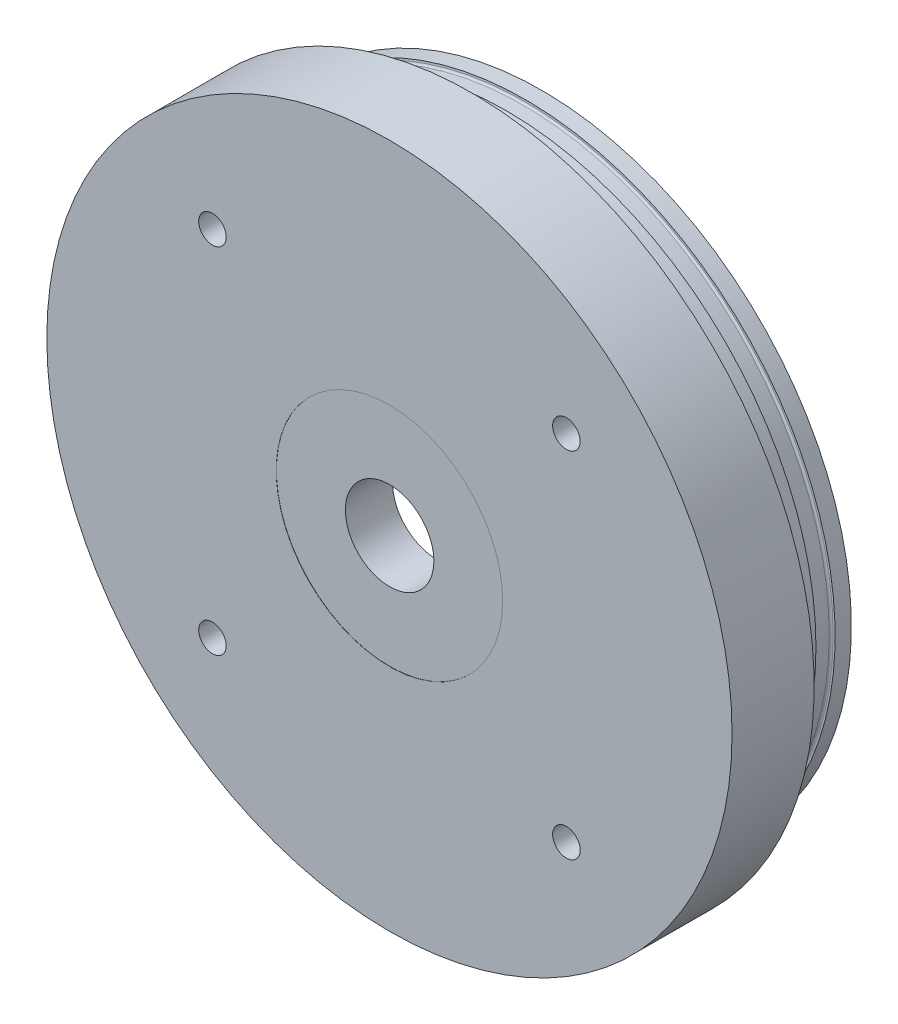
SolidWorks part; units mm, degrees
ref_plane "Front Plane" through (0, 0, 0) normal (0, 0, 1) x (1, 0, 0)
ref_plane "Top Plane" through (0, 0, 0) normal (0, 1, 0) x (1, 0, 0)
ref_plane "Right Plane" through (0, 0, 0) normal (1, 0, 0) x (0, 0, -1)
sketch "Sketch1" plane through (0, 0, 0) normal (0, 0, 1) x (1, 0, 0)
  circle A0 centre (0, 0) radius 43.0276
  dimension "D1" = 86.0552
extrude "Extrude1" add sketch "Sketch1" along normal blind 19.1262
ref_plane "Plane1" through (0, 0, 19.1262) normal (0, 0, 1) x (1, 0, 0)
sketch "Sketch3" plane through (0, 0, 19.1262) normal (0, 0, 1) x (1, 0, 0)
  circle A0 centre (0, 0) radius 42.926
hole_wizard "#4-40 Tapped Hole1" positions "3DSketch1" profile "Sketch5" tap size "#4-40" standard "Ansi Inch"
sketch3d "3DSketch1"
  point P40 (0, 32.639, 0)
  dimension "D1" = 32.639
sketch "Sketch5" plane through (0, 32.639, 0) normal (1, 0, 0) x (0, 1, 0)
  line L0 (0, 0) -> (0, 12.1092)
  line L1 (0, 12.1092) -> (1.1303, 11.43)
  line L2 (1.1303, 11.43) -> (1.1303, 0)
  line L5 (1.1303, 0) -> (0, 0)
  line L10 (0, 12.1092) -> (-1.1303, 11.43) construction
  line L11 (0, -6.35) -> (0, 107.95) construction
  dimension "Tap Drill Dia." = 2.2606
  dimension "Tap Drill Depth" = 11.43
  dimension "Drill Angle" = 118
sketch "Sketch6" plane through (0, 0, 19.1262) normal (0, 0, 1) x (1, 0, 0)
  circle A0 centre (0, 0) radius 9.525
extrude "Extrude5" [suppressed] cut sketch "Sketch6" against normal through all
sketch "Sketch11" plane through (0, 0, 0) normal (0, 0, -1) x (-1, 0, 0)
  circle A0 centre (0, 0) radius 56.9733
  circle A1 centre (0, 0) radius 38.8874
  dimension "D1" = 77.7748
extrude "Extrude9" cut sketch "Sketch11" against normal blind 8.8138
chamfer "Chamfer1" [suppressed] distance 0.635 angle 20
sketch "Sketch7" plane through (0, 0, 19.1262) normal (0, 0, 1) x (1, 0, 0)
  circle A0 centre (0, 0) radius 14.224
  dimension "D1" = 28.448
extrude "Extrude6" cut sketch "Sketch7" against normal blind 0.0254
hole_wizard "#6-32 Tapped Hole1" positions "3DSketch2" profile "Sketch8" tap size "#6-32" standard "Ansi Inch"
sketch3d "3DSketch2"
  line L16 (0, 0, 19.1262) -> (-12.9495, 12.9495, 19.1262) construction
  line L18 (0, 0, 19.1262) -> (0, 21.6239, 19.1262) construction
  circle A4 centre (0, 0, 19.1262) radius 42.926 construction
  point P47 (-12.9495, 12.9495, 19.1262)
  point P58 (0, 0, 62.0522)
  dimension "D1" = 18.3134
  dimension "D2" = 45
sketch "Sketch8" plane through (-12.9495, 12.9495, 19.1262) normal (1, 0, 0) x (0, -1, 0)
  line L0 (0, 0) -> (0, 12.0612)
  line L1 (0, 12.0612) -> (1.4732, 11.176)
  line L2 (1.4732, 11.176) -> (1.4732, 0)
  line L5 (1.4732, 0) -> (0, 0)
  line L10 (0, 12.0612) -> (-1.4732, 11.176) construction
  line L11 (0, -6.35) -> (0, 107.95) construction
  dimension "Tap Drill Dia." = 2.9464
  dimension "Tap Drill Depth" = 11.176
  dimension "Drill Angle" = 118
mirror "Mirror1" [suppressed] about plane through (0, 0, 0) normal (0, 1, 0)
mirror "Mirror2" [suppressed] about plane through (0, 0, 0) normal (1, 0, 0)
hole_wizard "#4-40 Tapped Hole2" positions "3DSketch3" profile "Sketch12" tap size "#4-40" standard "Ansi Inch"
sketch3d "3DSketch3"
  line L0 (0, 0, 0) -> (0, -32.8592, 0) construction
  point P0 (12.7, -31.3039, 0)
  point P2 (-12.7, -31.3039, 0)
  dimension "D1" = 25.4
  dimension "D2" = 33.782
  dimension "D3" = 12.7
sketch "Sketch12" plane through (12.7, -31.3039, 0) normal (1, 0, 0) x (0, 1, 0)
  line L0 (0, 0) -> (0, 12.1092)
  line L1 (0, 12.1092) -> (1.1303, 11.43)
  line L2 (1.1303, 11.43) -> (1.1303, 0)
  line L5 (1.1303, 0) -> (0, 0)
  line L10 (0, 12.1092) -> (-1.1303, 11.43) construction
  line L11 (0, -6.35) -> (0, 107.95) construction
  dimension "Tap Drill Dia." = 2.2606
  dimension "Tap Drill Depth" = 11.43
  dimension "Drill Angle" = 118
pattern_circular "CirPattern2" count 3 over 360 about axis through (0, 0, 0) along (0, 0, 1) of "#4-40 Tapped Hole1"
sketch "Sketch13" plane through (0, 0, 0) normal (0, 1, 0) x (1, 0, 0)
  line L0 (-42.926, -19.1262) -> (42.926, -19.1262) construction
  line L2 (0, -13.1826) -> (-14.1254, -13.1826)
  line L3 (-14.1254, -13.1826) -> (-14.1254, -8.5852)
  line L4 (-14.1254, -8.5852) -> (-28.575, 0)
  line L5 (38.8874, 0) -> (-38.8874, 0) construction
  line L6 (-28.575, 0) -> (0, 0)
  line L7 (0, 0) -> (0, -13.1826)
  dimension "D1" = 5.9436
  dimension "D2" = 4.5974
  dimension "D3" = 28.575
ref_axis "Axis1" [suppressed] through (0, 0, 0) along (0, 0, 1)
revolve "Cut-Revolve1" cut sketch "Sketch13" angle 360 about axis through (0, 0, 0) along (0, 0, 1)
hole_wizard "#8-32 Tapped Hole1" positions "3DSketch4" profile "Sketch14" tap size "#8-32" standard "Ansi Inch"
sketch3d "3DSketch4"
  line L0 (0, 0, 19.1008) -> (0, 49.4559, 19.1008) construction
  line L1 (0, 0, 19.1008) -> (0, 0, 19.1262) construction
  line L3 (0, 0, 19.1008) -> (-32.4571, 0, 19.1008) construction
  point P0 (-22.225, 22.225, 19.1262)
  point P2 (22.225, 22.225, 19.1262)
  point P7 (-22.225, -22.225, 19.1262)
  point P9 (22.225, -22.225, 19.1262)
  dimension "D1" = 44.45
  dimension "D2" = 44.45
  dimension "D3" = 22.225
  dimension "D4" = 22.225
sketch "Sketch14" plane through (-22.225, 22.225, 19.1262) normal (1, 0, 0) x (0, -1, 0)
  line L0 (0, 0) -> (0, 13.4838)
  line L1 (0, 13.4838) -> (1.7272, 12.446)
  line L2 (1.7272, 12.446) -> (1.7272, 0)
  line L5 (1.7272, 0) -> (0, 0)
  line L10 (0, 13.4838) -> (-1.7272, 12.446) construction
  line L11 (0, -6.35) -> (0, 107.95) construction
  dimension "Tap Drill Dia." = 3.4544
  dimension "Tap Drill Depth" = 12.446
  dimension "Drill Angle" = 118
pattern_circular "CirPattern1" count 3 over 360 about axis through (0, 0, 19.1262) along (0, 0, -1) of "#4-40 Tapped Hole1"
ref_plane "Plane2" through (0, 0, 8.8138) normal (-1, 0, 0) x (0, 1, 0)
ref_plane "Plane3" through (0, 0, 8.8138) normal (-1, 0, 0) x (0, 1, 0)
sketch "Sketch18" plane through (0, 0, 8.8138) normal (-1, 0, 0) x (0, 1, 0)
  line L0 (38.6494, 6.7503) -> (39.7764, 6.8489)
  line L1 (39.7764, 6.8489) -> (39.7764, 4.2895)
  line L2 (39.7764, 4.2895) -> (38.6494, 4.3881)
  line L3 (38.4175, 4.6412) -> (38.4175, 6.4973)
  line L4 (0, 50) -> (0, -50) construction
  arc A0 (38.6494, 4.3881) -> (38.4175, 4.6412) centre (38.6715, 4.6412) cw
  arc A1 (38.4175, 6.4973) -> (38.6494, 6.7503) centre (38.6715, 6.4973) cw
revolve "Groove for AS 568-041, O-Ring1" cut sketch "Sketch18"
ref_plane "Plane4" through (0, 0, 8.8138) normal (-1, 0, 0) x (0, 1, 0)
sketch "Sketch19" plane through (0, 0, 8.8138) normal (-1, 0, 0) x (0, 1, 0)
  line L0 (41.1353, -1.0889) -> (41.04, 0)
  line L1 (41.04, 0) -> (43.8722, 0)
  line L2 (43.8722, 0) -> (43.7769, -1.0889)
  line L3 (43.5239, -1.3208) -> (41.3883, -1.3208)
  line L4 (0, 50) -> (0, -50) construction
  arc A0 (43.7769, -1.0889) -> (43.5239, -1.3208) centre (43.5239, -1.0668) cw
  arc A1 (41.3883, -1.3208) -> (41.1353, -1.0889) centre (41.3883, -1.0668) cw
ref_plane "Plane5" through (0, 0, 8.8138) normal (-1, 0, 0) x (0, 1, 0)
sketch "Sketch20" plane through (0, 0, 8.8138) normal (-1, 0, 0) x (0, 1, 0)
  line L0 (41.1353, -1.0889) -> (41.04, 0)
  line L1 (41.04, 0) -> (43.8722, 0)
  line L2 (43.8722, 0) -> (43.7769, -1.0889)
  line L3 (43.5239, -1.3208) -> (41.3883, -1.3208)
  line L4 (0, 50) -> (0, -50) construction
  arc A0 (43.7769, -1.0889) -> (43.5239, -1.3208) centre (43.5239, -1.0668) cw
  arc A1 (41.3883, -1.3208) -> (41.1353, -1.0889) centre (41.3883, -1.0668) cw
ref_plane "Plane6" through (0, 0, 8.8138) normal (-1, 0, 0) x (0, 1, 0)
sketch "Sketch21" plane through (0, 0, 8.8138) normal (-1, 0, 0) x (0, 1, 0)
  line L0 (40.1003, -1.0889) -> (40.005, 0)
  line L1 (40.005, 0) -> (41.9227, 0)
  line L2 (41.9227, 0) -> (41.7954, -1.2071)
  line L3 (41.6691, -1.3208) -> (40.3533, -1.3208)
  line L4 (0, 50) -> (0, -50) construction
  arc A0 (41.7954, -1.2071) -> (41.6691, -1.3208) centre (41.6691, -1.1938) cw
  arc A1 (40.3533, -1.3208) -> (40.1003, -1.0889) centre (40.3533, -1.0668) cw
  dimension "D2" = 0.127
  dimension "D1" = 1.9177
  dimension "D3" = 40.005
revolve "Groove for AS 568-041, O-Ring2" cut sketch "Sketch21" angle 360 about L4
hole_wizard "7/16 (0.4375) Diameter Hole1" positions "3DSketch5" profile "Sketch22" hole size "7/16" standard "Ansi Inch"
sketch3d "3DSketch5"
  point P0 (0, 0, 19.1262)
sketch "Sketch22" plane through (0, 0, 19.1262) normal (1, 0, 0) x (0, -1, 0)
  line L0 (0, 0) -> (0, 19.1262)
  line L1 (0, 19.1262) -> (5.5562, 19.1262)
  line L2 (5.5562, 19.1262) -> (5.5562, 0)
  line L5 (5.5562, 0) -> (0, 0)
  line L11 (0, -6.35) -> (0, 107.95) construction
  dimension "Thru Hole Dia." = 11.1125
  dimension "Thru Hole Depth" = 19.1262
